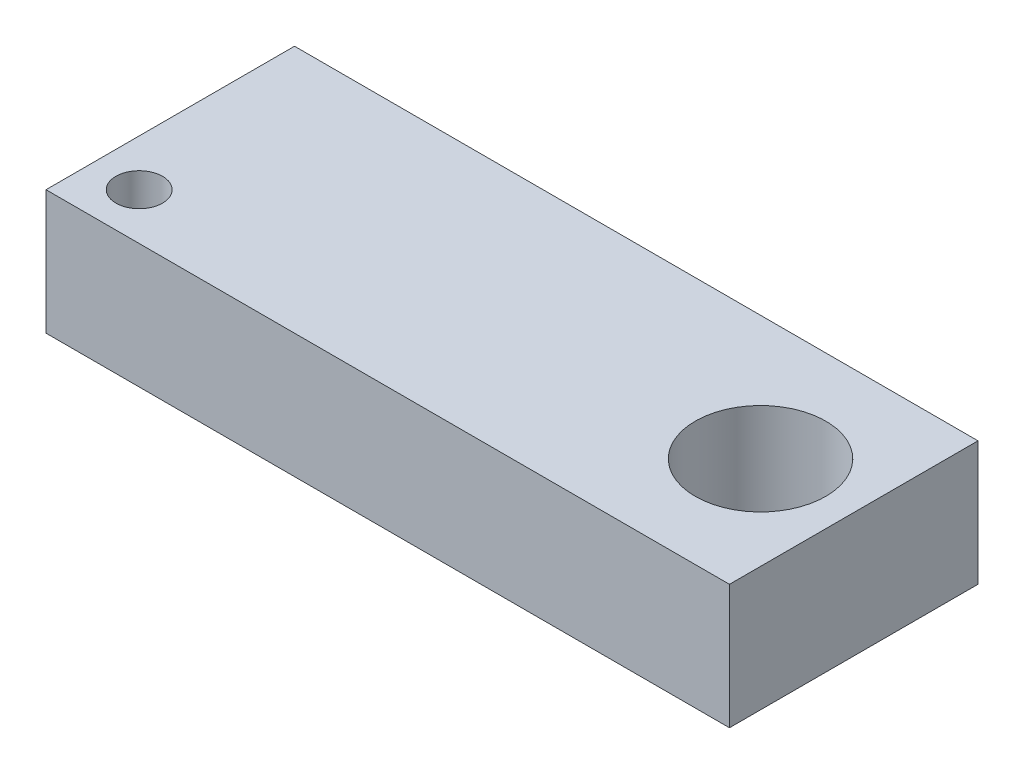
SolidWorks part; units mm, degrees
ref_plane "Face" through (0, 0, 0) normal (0, 0, 1) x (1, 0, 0)
ref_plane "Dessus" through (0, 0, 0) normal (0, 1, 0) x (1, 0, 0)
ref_plane "Droite" through (0, 0, 0) normal (1, 0, 0) x (0, 0, -1)
sketch "Esquisse1" plane through (0, 0, 0) normal (0, 0, 1) x (1, 0, 0)
  line L1 (0, 0) -> (220, 0)
  line L2 (0, 0) -> (0, 40)
  line L3 (0, 40) -> (220, 40)
  line L4 (220, 0) -> (220, 40)
  dimension "D1" = 220
  dimension "D2" = 40
extrude "Base-Extrusion" add sketch "Esquisse1" along normal blind 80
sketch "Esquisse2" plane through (0, 40, 0) normal (0, 1, 0) x (-1, 0, 0)
  line L0 (0, 40) -> (-220, 40) construction
  line L1 (0, 80) -> (0, 0) construction
  line L2 (-220, 80) -> (-220, 0) construction
  circle A0 centre (-190, 40) radius 21
  dimension "D1" = 42
  dimension "D2" = 190
extrude "Enlèv. mat.-Extru.1" cut sketch "Esquisse2" against normal through all
sketch "Esquisse3" plane through (0, 40, 0) normal (0, 1, 0) x (-1, 0, 0)
  line L0 (0, 80) -> (0, 0) construction
  line L1 (-220, 80) -> (0, 80) construction
  circle A0 centre (-15, 65) radius 7.5
  dimension "D1" = 15
  dimension "D2" = 15
  dimension "D3" = 15
extrude "Enlèv. mat.-Extru.2" cut sketch "Esquisse3" against normal through all
